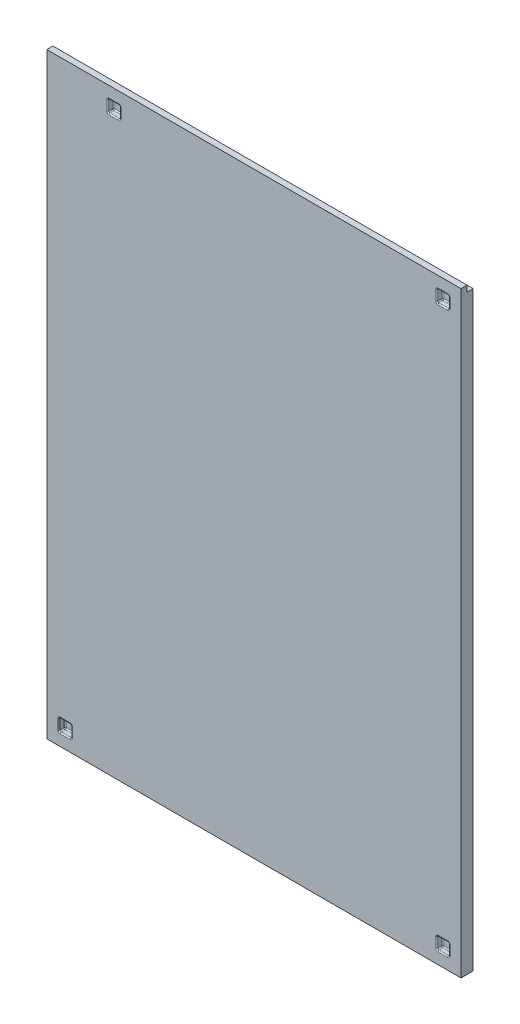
SolidWorks part; units mm, degrees
ref_plane "Ebene vorne" through (0, 0, 0) normal (0, 0, 1) x (1, 0, 0)
ref_plane "Ebene oben" through (0, 0, 0) normal (0, 1, 0) x (1, 0, 0)
ref_plane "Ebene rechts" through (0, 0, 0) normal (1, 0, 0) x (0, 0, -1)
sketch "Skizze1" plane through (0, 0, 0) normal (0, 0, 1) x (1, 0, 0)
  line L1 (0, 0) -> (68, 0)
  line L2 (0, 0) -> (0, 98)
  line L3 (0, 98) -> (68, 98)
  line L4 (68, 0) -> (68, 98)
  dimension "D1" = 98
  dimension "D2" = 68
extrude "Aufsatz-Linear austragen1" add sketch "Skizze1" along normal blind 2
sketch "Skizze2" plane through (0, 0, 2) normal (0, 0, 1) x (1, 0, 0)
  line L0 (68, 98) -> (0, 98) construction
  line L1 (64, 96) -> (66, 96)
  line L2 (64, 96) -> (64, 94)
  line L3 (64, 94) -> (66, 94)
  line L4 (66, 96) -> (66, 94)
  line L5 (68, 0) -> (68, 98) construction
  line L6 (68, 49) -> (0, 49) construction
  line L7 (0, 98) -> (0, 0) construction
  line L8 (38, 98) -> (38, 49) construction
  line L9 (12, 94) -> (10, 94)
  line L10 (10, 96) -> (10, 94)
  line L11 (12, 96) -> (10, 96)
  line L12 (12, 96) -> (12, 94)
  line L13 (64, 4) -> (66, 4)
  line L14 (66, 2) -> (66, 4)
  line L15 (64, 2) -> (66, 2)
  line L16 (64, 2) -> (64, 4)
  line L17 (34, 98) -> (34, 0) construction
  line L18 (0, 0) -> (68, 0) construction
  line L19 (4, 2) -> (4, 4)
  line L20 (4, 2) -> (2, 2)
  line L21 (2, 2) -> (2, 4)
  line L22 (4, 4) -> (2, 4)
  dimension "D1" = 2
  dimension "D2" = 2
  dimension "D3" = 2
  dimension "D4" = 2
  dimension "D5" = 30
extrude "Schnitt-Linear austragen1" cut sketch "Skizze2" against normal blind 1
fillet "Verrundung1" radius 0.2 48 edges at (4, 2, 1.5) (3, 2, 1) (2, 2, 1.5) (3, 2, 2) (2, 3, 2) (2, 3, 1) (2, 4, 1.5) (3, 4, 1) (4, 4, 1.5) (3, 4, 2) (4, 3, 1) (4, 3, 2) (64, 3, 1) (64, 2, 1.5) (65, 2, 1) (66, 2, 1.5) (65, 2, 2) (64, 3, 2) (64, 4, 1.5) (65, 4, 1) (65, 4, 2) (66, 4, 1.5) (66, 3, 1) (66, 3, 2) (65, 94, 1) (64, 94, 1.5) (64, 95, 1) (64, 95, 2) (64, 96, 1.5) (65, 96, 1) (65, 96, 2) (66, 96, 1.5) (66, 95, 1) (66, 94, 1.5) (65, 94, 2) (66, 95, 2) (12, 96, 1.5) (11, 96, 1) (10, 96, 1.5) (10, 95, 1) (10, 94, 1.5) (11, 94, 1) (11, 94, 2) (12, 94, 1.5) (12, 95, 1) (10, 95, 2) (11, 96, 2) (12, 95, 2)
sketch "Skizze3" plane through (0, 0, 0) normal (-1, 0, 0) x (0, 0, 1)
  line L1 (1, 97) -> (0, 97)
  line L2 (1, 97) -> (1, 98)
  line L3 (1, 98) -> (0, 98)
  line L4 (0, 97) -> (0, 98)
  dimension "D1" = 1
  dimension "D2" = 1
extrude "Schnitt-Linear austragen2" cut sketch "Skizze3" against normal blind 68
